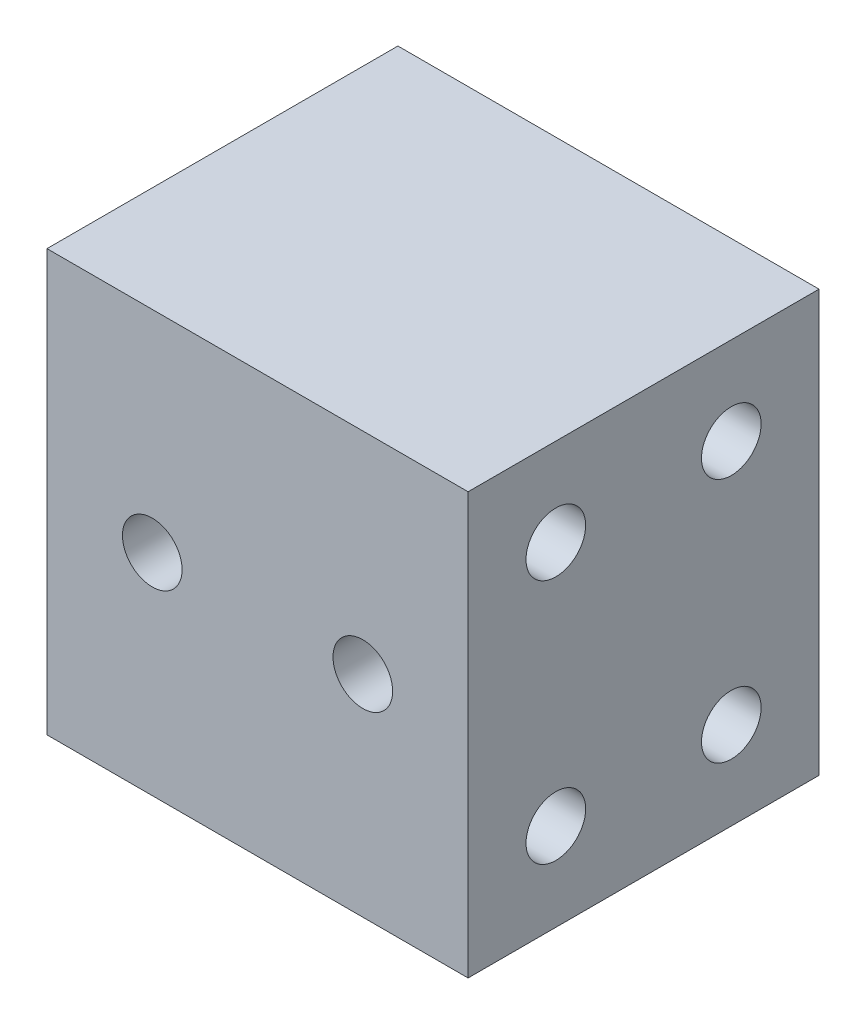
SolidWorks part; units mm, degrees
ref_plane "前视基准面" through (0, 0, 0) normal (0, 0, 1) x (1, 0, 0)
ref_plane "上视基准面" through (0, 0, 0) normal (0, 1, 0) x (1, 0, 0)
ref_plane "右视基准面" through (0, 0, 0) normal (1, 0, 0) x (0, 0, -1)
other "Configuration Table"
sketch "草图1" plane through (0, 0, 0) normal (0, 0, 1) x (1, 0, 0)
  line L1 (-12, -12) -> (12, -12)
  line L2 (-12, -12) -> (-12, 12)
  line L3 (-12, 12) -> (12, 12)
  line L4 (12, -12) -> (12, 12)
  circle A0 centre (-6, 0) radius 1.7
  circle A1 centre (6, 0) radius 1.7
extrude "Wrist_spacer_W20" add sketch "草图1" along normal blind 20
sketch "草图2" plane through (0, 0, 0) normal (1, 0, 0) x (0, 0, -1)
  circle A0 centre (-5, -7) radius 1.7
  circle A1 centre (-15, -7) radius 1.7
  circle A2 centre (-5, 7) radius 1.7
  circle A3 centre (-15, 7) radius 1.7
extrude "Gripper_adapter_M3_14x10_NOT_SG90_DIRECT" cut sketch "草图2" against normal through all and the other way through all
